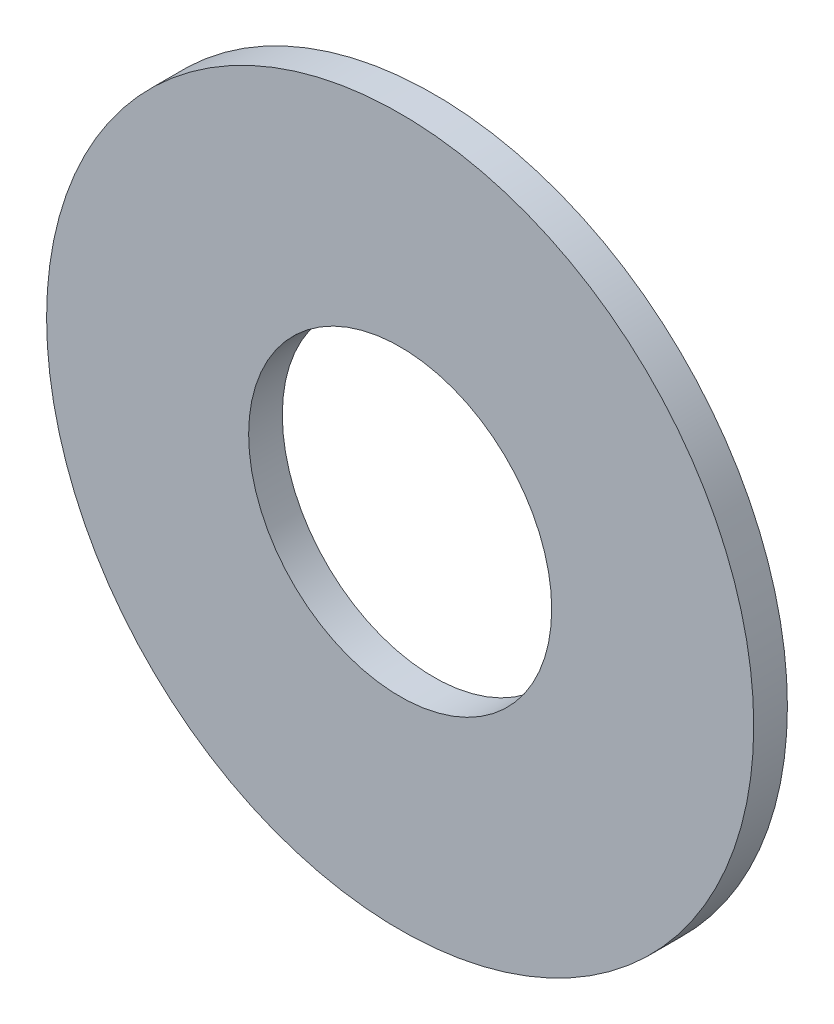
SolidWorks part; units mm, degrees
ref_plane "Face" through (0, 0, 0) normal (0, 0, 1) x (1, 0, 0)
ref_plane "Dessus" through (0, 0, 0) normal (0, 1, 0) x (1, 0, 0)
ref_plane "Droite" through (0, 0, 0) normal (1, 0, 0) x (0, 0, -1)
sketch "Esquisse1" plane through (0, 0, 0) normal (0, 0, 1) x (1, 0, 0)
  circle A0 centre (0, 0) radius 4.5
  circle A1 centre (0, 0) radius 10.5
  dimension "D1" = 6
extrude "Extrusion1" add sketch "Esquisse1" along normal blind 1
